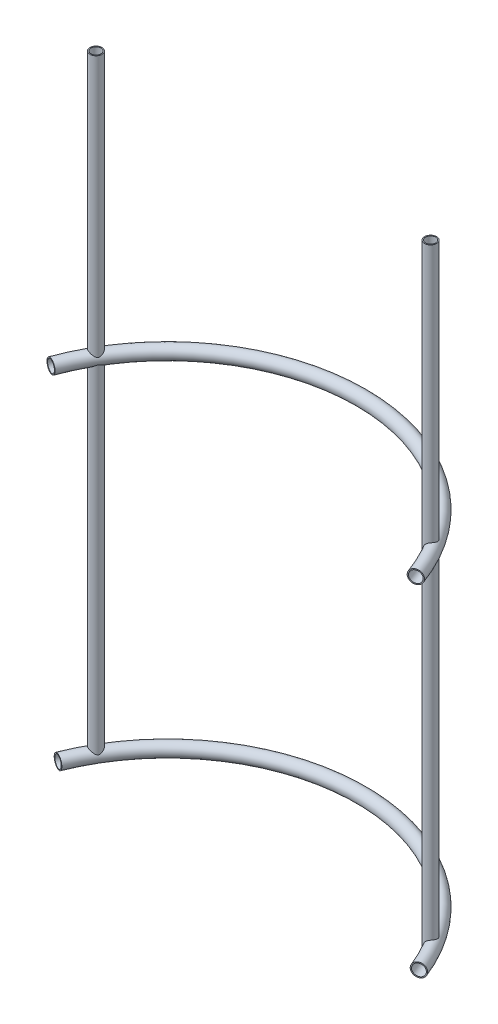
SolidWorks part; units mm, degrees
ref_plane "Plan de face" through (0, 0, 0) normal (0, 0, 1) x (1, 0, 0)
ref_plane "Plan de dessus" through (0, 0, 0) normal (0, 1, 0) x (1, 0, 0)
ref_plane "Plan de droite" through (0, 0, 0) normal (1, 0, 0) x (0, 0, -1)
sketch "Esquisse1" plane through (0, 0, 0) normal (0, 1, 0) x (1, 0, 0)
  line L0 (0, 0) -> (-419.1563, 242) construction
  line L1 (0, 0) -> (0, 484) construction
  line L2 (0, 0) -> (419.1563, 242) construction
  circle A0 centre (0, 0) radius 484 construction
  dimension "D1" = 968
  dimension "D2" = 60
  dimension "D3" = 419.1563
  dimension "D4" = 242
  dimension "D5" = 419.1563
  dimension "D6" = 242
sketch "Esquisse2" plane through (0, 0, 0) normal (0, 1, 0) x (1, 0, 0)
  line L0 (-450, 178.2021) -> (450, 178.2021) construction
  line L1 (0, 484) -> (-236.5047, 484) construction
  arc A0 (-450, 178.2021) -> (450, 178.2021) centre (0, 0) cw
  circle A1 centre (0, 0) radius 484 construction
  circle A2 centre (-419.1563, 242) radius 16.85 construction
  dimension "D2" = 33.7
  dimension "D1" = 900
ref_plane "Plan1" through (450, 0, -178.2021) normal (-0.3682, 0, -0.9298) x (-0.9298, 0, 0.3682)
sketch "Esquisse3" plane through (450, 0, -178.2021) normal (-0.3682, 0, -0.9298) x (-0.9298, 0, 0.3682)
  line L0 (968, 0) -> (0, 0) construction
  circle A0 centre (0, 0) radius 16.85
  circle A1 centre (0, 0) radius 14.35
  dimension "D1" = 33.7
  dimension "D2" = 2.5
sweep "Balayage1" add profiles "Esquisse3" path "Esquisse2"
ref_plane "Plan2" through (0, 1518, 0) normal (0, 1, 0) x (-1, 0, 0)
sketch "Esquisse4" plane through (0, 1518, 0) normal (0, 1, 0) x (-1, 0, 0)
  line L0 (0, 0) -> (0, -568.7751) construction
  line L1 (419.16, -242) -> (0, 0) construction
  line L2 (0, 0) -> (-406.436, -250.7473) construction
  circle A0 centre (-406.436, -250.7473) radius 12.5
  circle A1 centre (-406.436, -250.7473) radius 15
  circle A2 centre (419.16, -242) radius 12.5
  circle A3 centre (419.16, -242) radius 15
  point P5 (-406.436, -250.7473)
  dimension "D1" = 419.16
  dimension "D3" = 242
  dimension "D5" = 30
  dimension "D6" = 25
  dimension "D7" = 30
  dimension "D8" = 25
extrude "Extrusion1" add sketch "Esquisse4" against normal up to surface (1534.851 mm away) separate body
sketch "Esquisse6" plane through (0, 0, 0) normal (1, 0, 0) x (0, 0, -1)
  line L0 (484, 0) -> (484, 858) construction
  line L1 (0, 0) -> (484, 0) construction
  line L2 (0, 0) -> (0, 1087.1051) construction
  circle A0 centre (484, 858) radius 16.85
  circle A1 centre (484, 858) radius 14.35
  dimension "D1" = 33.7
  dimension "D2" = 2.5
  dimension "D3" = 858
revolve "Révolution1" add sketch "Esquisse6" angle 70 about L2
ref_plane "Plan3" through (0, 0, 0) normal (0.5, 0, 0.866) x (0.866, 0, -0.5)
